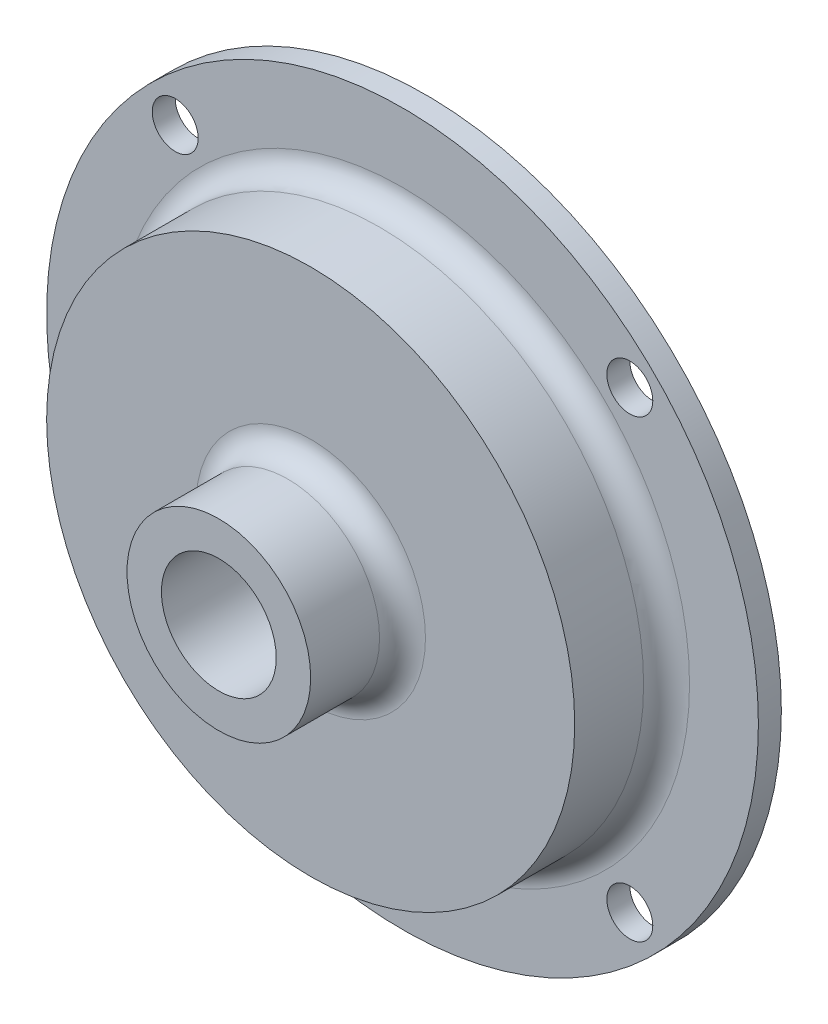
SolidWorks part; units mm, degrees
ref_plane "Front" through (0, 0, 0) normal (0, 0, 1) x (1, 0, 0)
ref_plane "Top" through (0, 0, 0) normal (0, 1, 0) x (1, 0, 0)
ref_plane "Right" through (0, 0, 0) normal (1, 0, 0) x (0, 0, -1)
sketch "Sketch1" plane through (0, 0, 0) normal (0, 0, 1) x (1, 0, 0)
  line L0 (0, 0) -> (49.2125, 0) construction
  line L1 (0, 0) -> (34.7985, 34.7985) construction
  line L2 (0, 0) -> (-34.7985, 34.7985) construction
  circle A0 centre (0, 0) radius 49.2125
  circle A1 centre (0, 0) radius 44.45 construction
  circle A2 centre (31.4309, 31.4309) radius 3.175
  circle A4 centre (-31.4309, -31.4309) radius 3.175
  circle A6 centre (31.4309, -31.4309) radius 3.175
  circle A7 centre (-31.4309, 31.4309) radius 3.175
  dimension "D1" = 98.425
  dimension "D3" = 6.35
  dimension "D4" = 88.9
  dimension "D2" = 45
extrude "Base-Extrude" add sketch "Sketch1" along normal blind 3.175
sketch "Sketch2" plane through (0, 0, 3.175) normal (0, 0, 1) x (1, 0, 0)
  circle A0 centre (0, 0) radius 36.5125
  dimension "D1" = 73.025
extrude "Boss-Extrude1" add sketch "Sketch2" along normal blind 12.7
sketch "Sketch3" plane through (0, 0, 15.875) normal (0, 0, 1) x (1, 0, 0)
  circle A0 centre (0, 0) radius 12.7
  dimension "D1" = 25.4
extrude "Boss-Extrude2" add sketch "Sketch3" along normal blind 12.7
fillet "Fillet1" radius 3.175 2 edges at (36.5125, 0, 3.175) (12.7, 0, 15.875)
sketch "Sketch4" plane through (0, 0, 28.575) normal (0, 0, 1) x (1, 0, 0)
  circle A0 centre (0, 0) radius 7.9375
  dimension "D1" = 15.875
extrude "Cut-Extrude1" cut sketch "Sketch4" against normal through all
